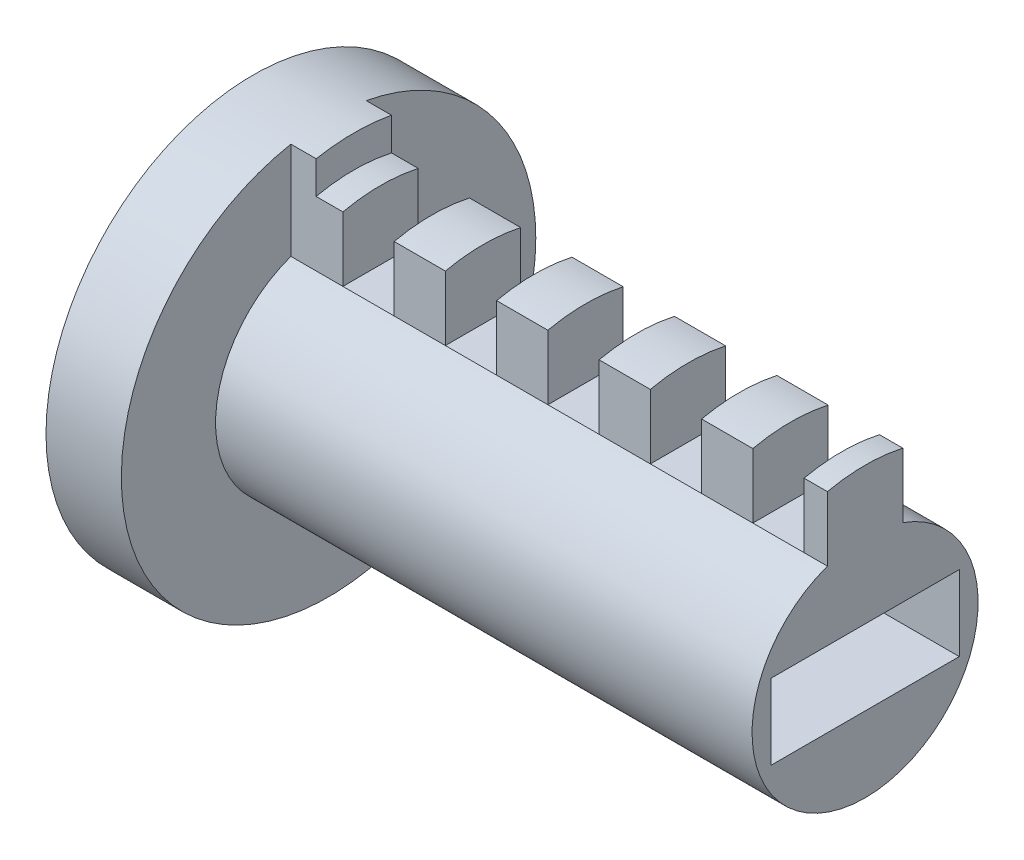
SolidWorks part; units mm, degrees
ref_plane "Front Plane" through (0, 0, 0) normal (0, 0, 1) x (1, 0, 0)
ref_plane "Top Plane" through (0, 0, 0) normal (0, 1, 0) x (1, 0, 0)
ref_plane "Right Plane" through (0, 0, 0) normal (1, 0, 0) x (0, 0, -1)
sketch "Sketch3" plane through (0, 0, 0) normal (1, 0, 0) x (0, 0, -1)
  line L1 (6.35, -2.54) -> (-6.35, -2.54)
  line L2 (6.35, -2.54) -> (6.35, 2.54)
  line L3 (6.35, 2.54) -> (-6.35, 2.54)
  line L4 (-6.35, -2.54) -> (-6.35, 2.54)
  line L5 (6.35, -2.54) -> (-6.35, 2.54) construction
  line L6 (6.35, 2.54) -> (-6.35, -2.54) construction
  line L7 (2.54, -11.5346) -> (-2.54, -11.5346)
  line L8 (2.54, -11.5346) -> (2.54, 11.5346)
  line L9 (2.54, 11.5346) -> (-2.54, 11.5346)
  line L10 (-2.54, -11.5346) -> (-2.54, 11.5346)
  line L11 (2.54, -11.5346) -> (-2.54, 11.5346) construction
  line L12 (2.54, 11.5346) -> (-2.54, -11.5346) construction
  circle A0 centre (0, 0) radius 11.811
  circle A1 centre (0, 0) radius 7.62
  circle A2 centre (0, 0) radius 11.811
  dimension "D4" = 15.24
  dimension "D5" = 23.622
  dimension "D6" = 23.622
  dimension "D1" = 12.7
  dimension "D2" = 12.7
  dimension "D3" = 5.08
  dimension "D7" = 5.08
extrude "Boss-Extrude3" add sketch "Sketch3" along normal blind 38.1 contours L10 A1 L1 L4 L3 | L10 A1 L8 L1 | L8 A1 L3 L2 L1 | L8 A1 L10 L3 | A1 L8 A0 L10 | L9 A0 | A2
sketch "Sketch4" plane through (0, 0, 0) normal (0, 0, 1) x (1, 0, 0)
  line L0 (38.1, 11.5346) -> (38.1, 11.811) construction
  line L1 (0, 7.1842) -> (38.1, 7.1842)
  line L2 (0, 7.1842) -> (0, 14.5328)
  line L3 (0, 14.5328) -> (38.1, 14.5328)
  line L4 (38.1, 7.1842) -> (38.1, 14.5328)
  line L5 (0, 10.8585) -> (38.1, 10.8585) construction
  line L6 (34.5948, 7.1842) -> (31.1404, 14.5328) construction
  line L7 (19.05, 7.1842) -> (19.05, 14.5328) construction
  line L8 (10.414, 14.5328) -> (13.8684, 14.5328)
  line L9 (20.7772, 14.5328) -> (17.3228, 14.5328)
  line L10 (20.7772, 14.5328) -> (20.7772, 7.1842)
  line L11 (20.7772, 7.1842) -> (17.3228, 7.1842)
  line L12 (17.3228, 14.5328) -> (17.3228, 7.1842)
  line L13 (20.7772, 14.5328) -> (17.3228, 7.1842) construction
  line L14 (20.7772, 7.1842) -> (17.3228, 14.5328) construction
  line L15 (10.414, 14.5328) -> (10.414, 7.1842)
  line L16 (10.414, 7.1842) -> (13.8684, 7.1842)
  line L17 (13.8684, 14.5328) -> (13.8684, 7.1842)
  line L18 (10.414, 14.5328) -> (13.8684, 7.1842) construction
  line L19 (10.414, 7.1842) -> (13.8684, 14.5328) construction
  line L20 (3.5052, 14.5328) -> (6.9596, 14.5328)
  line L21 (3.5052, 14.5328) -> (3.5052, 7.1842)
  line L22 (3.5052, 7.1842) -> (6.9596, 7.1842)
  line L23 (6.9596, 14.5328) -> (6.9596, 7.1842)
  line L24 (3.5052, 14.5328) -> (6.9596, 7.1842) construction
  line L25 (3.5052, 7.1842) -> (6.9596, 14.5328) construction
  line L26 (34.5948, 14.5328) -> (31.1404, 7.1842) construction
  line L27 (27.686, 7.1842) -> (24.2316, 14.5328) construction
  line L28 (27.686, 14.5328) -> (24.2316, 7.1842) construction
  line L29 (17.3228, 7.1842) -> (20.7772, 14.5328) construction
  line L30 (17.3228, 14.5328) -> (20.7772, 7.1842) construction
  line L31 (31.1404, 14.5328) -> (31.1404, 7.1842)
  line L32 (34.5948, 7.1842) -> (31.1404, 7.1842)
  line L33 (34.5948, 14.5328) -> (34.5948, 7.1842)
  line L34 (34.5948, 14.5328) -> (31.1404, 14.5328)
  line L35 (24.2316, 14.5328) -> (24.2316, 7.1842)
  line L36 (27.686, 7.1842) -> (24.2316, 7.1842)
  line L37 (27.686, 14.5328) -> (27.686, 7.1842)
  line L38 (20.7772, 14.5328) -> (20.7772, 7.1842)
  line L39 (17.3228, 14.5328) -> (17.3228, 7.1842)
  line L40 (27.686, 14.5328) -> (24.2316, 14.5328)
  point P8 (19.05, 10.8585)
  point P15 (12.1412, 10.8585)
  point P20 (5.2324, 10.8585)
  point P35 (32.8676, 10.8585)
  point P36 (25.9588, 10.8585)
  dimension "D1" = 3.4544
  dimension "D2" = 3.4544
  dimension "D3" = 3.4544
  dimension "D4" = 3.4544
  dimension "D5" = 3.4544
extrude "Cut-Extrude1" cut sketch "Sketch4" against normal mid plane 27.94 contours L33 L3 L31 L1 | L37 L3 L35 L1 | L3 L12 L1 L10 | L17 L3 L15 L1 | L23 L3 L21 L1
sketch "Sketch5" plane through (0, 0, 0) normal (1, 0, 0) x (0, 0, -1)
  circle A0 centre (0, 0) radius 11.811
  circle A1 centre (0, 0) radius 10.4412
  circle A2 centre (0, 0) radius 13.97
  dimension "D1" = 27.94
extrude "Boss-Extrude4" add sketch "Sketch5" against normal blind 5.08 contours A0 | A1 A0 | A2 A0
sketch "Sketch6" plane through (0, 0, 0) normal (1, 0, 0) x (0, 0, -1)
  line L0 (-2.54, 7.1842) -> (-2.54, 11.5346) construction
  line L1 (2.54, 7.1842) -> (2.54, 11.5346) construction
  line L2 (-2.54, 7.1842) -> (-2.54, 11.5346)
  line L3 (2.54, 7.1842) -> (2.54, 11.5346)
  line L4 (-2.54, 11.5346) -> (-2.54, 13.7372)
  line L5 (2.54, 11.5346) -> (2.54, 13.7372)
  line L6 (2.794, 11.5346) -> (2.794, 13.7372)
  circle A0 centre (0, 0) radius 13.97 construction
  arc A1 (2.54, 11.5346) -> (-2.54, 11.5346) centre (0, 0) ccw construction
  circle A2 centre (0, 0) radius 13.97
  arc A3 (2.54, 11.5346) -> (-2.54, 11.5346) centre (0, 0) ccw
  arc A4 (2.5946, 11.7827) -> (-2.5946, 11.7827) centre (0, 0) ccw
  dimension "D1" = 0.254
extrude "Boss-Extrude5" add sketch "Sketch6" along normal blind 1.7018 contours A4 L5 L4 M1 | L5 A4 L4 M4
sketch "Sketch7" plane through (0, 0, 0) normal (0, 0, 1) x (1, 0, 0)
  line L1 (38.1, -7.62) -> (36.1696, -7.62)
  line L2 (38.1, -7.62) -> (38.1, 17.8413)
  line L3 (38.1, 17.8413) -> (36.1696, 17.8413)
  line L4 (36.1696, -7.62) -> (36.1696, 17.8413)
  dimension "D1" = 1.9304
extrude "Cut-Extrude2" cut sketch "Sketch7" against normal mid plane 25.4
